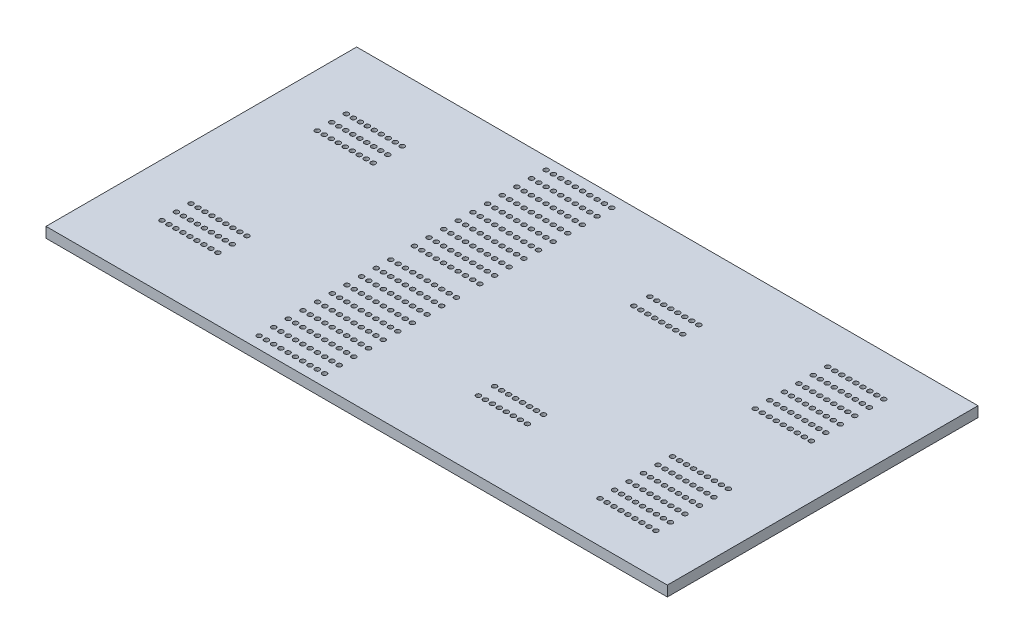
SolidWorks part; units mm, degrees
ref_plane "Plan de face" through (0, 0, 0) normal (0, 0, 1) x (1, 0, 0)
ref_plane "Plan de dessus" through (0, 0, 0) normal (0, 1, 0) x (1, 0, 0)
ref_plane "Plan de droite" through (0, 0, 0) normal (1, 0, 0) x (0, 0, -1)
sketch "Esquisse2" plane through (0, 0, 0) normal (0, 1, 0) x (1, 0, 0)
  line L1 (-60, -15) -> (60, -15)
  line L2 (-60, -15) -> (-60, 15)
  line L3 (-60, 15) -> (60, 15)
  line L4 (60, -15) -> (60, 15)
  line L5 (-60, -15) -> (60, 15) construction
  line L6 (-60, 15) -> (60, -15) construction
  point P0 (0, 0)
  dimension "D1" = 30
  dimension "D2" = 120
extrude "Boss.-Extru.1" add sketch "Esquisse2" along normal blind 2 contours L3 L4 L1 L2
sketch "Cavités" plane through (0, 0, 0) normal (0, 1, 0) x (1, 0, 0)
  line L0 (-60, -15) -> (60, -15) construction
  line L1 (-58.4, 15) -> (-30.4, 15) construction
  line L2 (-58.4, 15) -> (-58.4, -15) construction
  line L3 (-58.4, -15) -> (-30.4, -15) construction
  line L4 (-30.4, 15) -> (-30.4, -15) construction
  line L5 (-60, 15) -> (60, 15) construction
  line L6 (-28.8, 15) -> (-0.8, 15) construction
  line L7 (-28.8, 15) -> (-28.8, -15) construction
  line L8 (-28.8, -15) -> (-0.8, -15) construction
  line L9 (-0.8, 15) -> (-0.8, -15) construction
  line L10 (-30.4, 15) -> (-28.8, 15) construction
  line L11 (0.8, 15) -> (28.8, 15) construction
  line L12 (0.8, 15) -> (0.8, -15) construction
  line L13 (0.8, -15) -> (28.8, -15) construction
  line L14 (28.8, 15) -> (28.8, -15) construction
  line L15 (30.4, 15) -> (58.4, 15) construction
  line L16 (30.4, 15) -> (30.4, -15) construction
  line L17 (30.4, -15) -> (58.4, -15) construction
  line L18 (58.4, 15) -> (58.4, -15) construction
  line L19 (-0.8, 15) -> (0.8, 15) construction
  line L20 (28.8, 15) -> (30.4, 15) construction
  line L21 (-60, 15) -> (-58.4, 15) construction
  line L22 (58.4, 15) -> (60, 15) construction
  dimension "D1" = 28
  dimension "D2" = 1.6
sketch "Esquisse7" plane through (0, 2, 0) normal (0, 1, 0) x (1, 0, 0)
  line L0 (-58.4, 0) -> (-49.8, 0) construction
  line L1 (-49.8, 2.8) -> (-39, 2.8) construction
  line L2 (-49.8, 2.8) -> (-49.8, -2.8) construction
  line L3 (-49.8, -2.8) -> (-39, -2.8) construction
  line L4 (-39, 2.8) -> (-39, -2.8) construction
  line L5 (-58.4, 15) -> (-58.4, -15) construction
  line L6 (-39, 0) -> (-30.4, 0) construction
  line L7 (-30.4, 15) -> (-30.4, -15) construction
  dimension "D1" = 10.8
  dimension "D2" = 5.6
sketch "Esquisse8" plane through (0, 2, 0) normal (0, 1, 0) x (1, 0, 0)
  circle A0 centre (-49.8, 2.8) radius 0.45
  dimension "D1" = 0.9
extrude "Enlèv. mat.-Extru.3" cut sketch "Esquisse8" against normal up to next
pattern_linear "Répétition linéaire4" count 9 spacing 1.35 along (1, 0, 0) count 3 spacing 2.8 along (0, 0, 1) of "Enlèv. mat.-Extru.3"
sketch "Esquisse9" plane through (0, 2, 0) normal (0, 1, 0) x (1, 0, 0)
  line L0 (-28.8, 0) -> (-21.127, 0) construction
  line L1 (-21.127, 12.725) -> (-8.473, 12.725) construction
  line L2 (-21.127, 12.725) -> (-21.127, -12.725) construction
  line L3 (-21.127, -12.725) -> (-8.473, -12.725) construction
  line L4 (-8.473, 12.725) -> (-8.473, -12.725) construction
  line L5 (-28.8, 15) -> (-28.8, -15) construction
  line L6 (-8.473, 0) -> (-0.8, 0) construction
  line L7 (-0.8, 15) -> (-0.8, -15) construction
  dimension "D1" = 12.654
  dimension "D2" = 25.45
sketch "Esquisse10" plane through (0, 2, 0) normal (0, 1, 0) x (1, 0, 0)
  circle A0 centre (-21.127, 12.725) radius 0.45
  dimension "D1" = 0.9
extrude "Enlèv. mat.-Extru.4" cut sketch "Esquisse10" against normal up to next
pattern_linear "Répétition linéaire5" count 10 spacing 1.406 along (1, 0, 0) count 10 spacing 2.8278 along (0, 0, 1) of "Enlèv. mat.-Extru.4"
sketch "Esquisse11" plane through (0, 2, 0) normal (0, 1, 0) x (1, 0, 0)
  line L0 (0.8, 0) -> (10.075, 0) construction
  line L1 (10.075, 1.5555) -> (19.525, 1.5555) construction
  line L2 (10.075, 1.5555) -> (10.075, -1.5555) construction
  line L3 (10.075, -1.5555) -> (19.525, -1.5555) construction
  line L4 (19.525, 1.5555) -> (19.525, -1.5555) construction
  line L5 (0.8, 15) -> (0.8, -15) construction
  line L6 (19.525, 0) -> (28.8, 0) construction
  line L7 (28.8, 15) -> (28.8, -15) construction
  dimension "D1" = 9.45
  dimension "D2" = 3.111
sketch "Esquisse12" plane through (0, 2, 0) normal (0, 1, 0) x (1, 0, 0)
  circle A0 centre (10.075, 1.5555) radius 0.45
  dimension "D1" = 0.9
extrude "Enlèv. mat.-Extru.5" cut sketch "Esquisse12" against normal up to next
pattern_linear "Répétition linéaire6" count 8 spacing 1.35 along (1, 0, 0) count 2 spacing 3.111 along (0, 0, 1) of "Enlèv. mat.-Extru.5"
sketch "Esquisse13" plane through (0, 2, 0) normal (0, 1, 0) x (1, 0, 0)
  line L0 (30.4, 0) -> (39, 0) construction
  line L1 (39, 7) -> (49.8, 7) construction
  line L2 (39, 7) -> (39, -7) construction
  line L3 (39, -7) -> (49.8, -7) construction
  line L4 (49.8, 7) -> (49.8, -7) construction
  line L5 (30.4, 15) -> (30.4, -15) construction
  line L6 (49.8, 0) -> (58.4, 0) construction
  line L7 (58.4, 15) -> (58.4, -15) construction
  dimension "D1" = 14
  dimension "D2" = 10.8
sketch "Esquisse14" plane through (0, 2, 0) normal (0, 1, 0) x (1, 0, 0)
  circle A0 centre (39, 7) radius 0.45
  dimension "D1" = 0.9
extrude "Enlèv. mat.-Extru.6" cut sketch "Esquisse14" against normal up to next
pattern_linear "Répétition linéaire7" count 9 spacing 1.35 along (1, 0, 0) count 6 spacing 2.8 along (0, 0, 1) of "Enlèv. mat.-Extru.6"
mirror "Symétrie1" about plane through (-60, 2, 15) normal (0, 0, -1)
